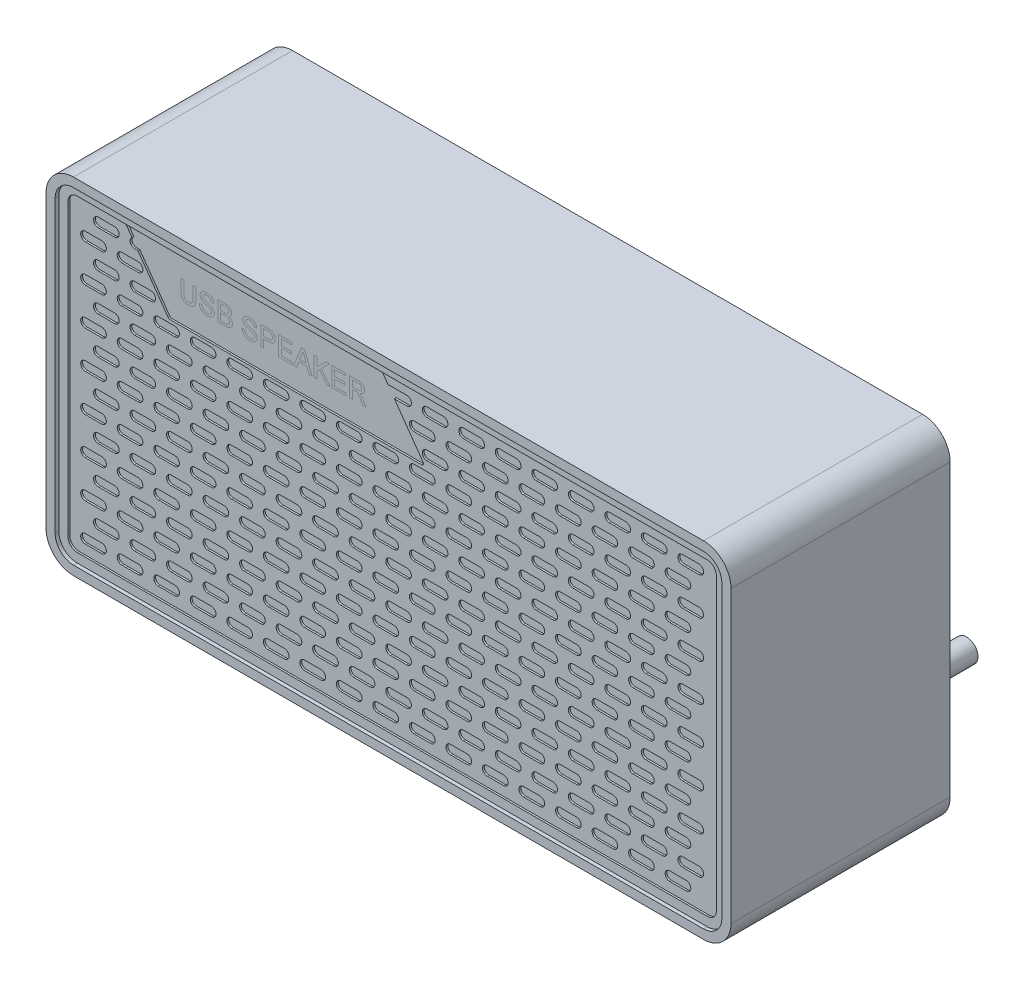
SolidWorks part; units mm, degrees
ref_plane "Front Plane" through (0, 0, 0) normal (0, 0, 1) x (1, 0, 0)
ref_plane "Top Plane" through (0, 0, 0) normal (0, 1, 0) x (1, 0, 0)
ref_plane "Right Plane" through (0, 0, 0) normal (1, 0, 0) x (0, 0, -1)
sketch "Sketch1" plane through (0, 0, 0) normal (0, 1, 0) x (1, 0, 0)
  line L1 (-47.498, 15.1892) -> (47.498, 15.1892)
  line L2 (-47.498, 15.1892) -> (-47.498, -15.1892)
  line L3 (-47.498, -15.1892) -> (47.498, -15.1892)
  line L4 (47.498, 15.1892) -> (47.498, -15.1892)
  line L5 (-47.498, 15.1892) -> (47.498, -15.1892) construction
  line L6 (-47.498, -15.1892) -> (47.498, 15.1892) construction
  point P0 (0, 0)
  dimension "D1" = 94.996
  dimension "D2" = 30.3784
extrude "Boss-Extrude1" add sketch "Sketch1" along normal blind 47.879
fillet "Fillet1" radius 3.81 4 edges at (-47.498, 0, 0) (-47.498, 47.879, 0) (47.498, 0, 0) (47.498, 47.879, 0)
sketch "Sketch2" plane through (0, 0, 15.1892) normal (0, 0, 1) x (1, 0, 0)
  line L0 (-43.688, 47.879) -> (43.688, 47.879) construction
  line L1 (-46.228, 46.609) -> (46.228, 46.609)
  line L2 (-46.228, 46.609) -> (-46.228, 1.27)
  line L3 (-46.228, 1.27) -> (46.228, 1.27)
  line L4 (46.228, 46.609) -> (46.228, 1.27)
  line L5 (-43.688, 0) -> (43.688, 0) construction
  line L6 (-47.498, 44.069) -> (-47.498, 3.81) construction
  line L7 (47.498, 44.069) -> (47.498, 3.81) construction
  dimension "D1" = 1.27
  dimension "D2" = 1.27
  dimension "D3" = 1.27
  dimension "D4" = 1.27
extrude "Cut-Extrude1" cut sketch "Sketch2" against normal blind 0.508
fillet "Fillet2" radius 2.54 4 edges at (46.228, 1.27, 14.9352) (46.228, 46.609, 14.9352) (-46.228, 1.27, 14.9352) (-46.228, 46.609, 14.9352)
sketch "Sketch3" plane through (0, 0, 14.6812) normal (0, 0, 1) x (1, 0, 0)
  line L0 (43.688, 46.609) -> (-43.688, 46.609) construction
  line L1 (-44.958, 45.339) -> (44.958, 45.339)
  line L2 (-44.958, 45.339) -> (-44.958, 2.54)
  line L3 (-44.958, 2.54) -> (44.958, 2.54)
  line L4 (44.958, 45.339) -> (44.958, 2.54)
  line L5 (-43.688, 1.27) -> (43.688, 1.27) construction
  line L6 (-46.228, 44.069) -> (-46.228, 3.81) construction
  line L7 (46.228, 3.81) -> (46.228, 44.069) construction
  dimension "D1" = 1.27
  dimension "D2" = 1.27
  dimension "D3" = 1.27
  dimension "D4" = 1.27
extrude "Cut-Extrude2" cut sketch "Sketch3" against normal blind 0.254
fillet "Fillet3" radius 1.27 4 edges at (44.958, 2.54, 14.5542) (44.958, 45.339, 14.5542) (-44.958, 2.54, 14.5542) (-44.958, 45.339, 14.5542)
sketch "Sketch6" plane through (0, 0, 14.4272) normal (0, 0, 1) x (1, 0, 0)
  line L0 (-37.338, 45.339) -> (-1.778, 45.339)
  line L1 (-1.778, 45.339) -> (4.318, 36.703)
  line L2 (4.318, 36.703) -> (-31.242, 36.703)
  line L3 (-31.242, 36.703) -> (-37.338, 45.339)
  line L4 (-44.958, 44.069) -> (-44.958, 3.81) construction
  line L5 (43.688, 45.339) -> (-43.688, 45.339) construction
  dimension "D1" = 35.56
  dimension "D2" = 8.636
  dimension "D3" = 6.096
  dimension "D4" = 7.62
extrude "Cut-Extrude5" cut sketch "Sketch6" against normal blind 0.254
fillet "Fillet4" radius 0.254 4 edges at (-1.778, 45.339, 14.3002) (4.318, 36.703, 14.3002) (-37.338, 45.339, 14.3002) (-31.242, 36.703, 14.3002)
sketch "Sketch5" plane through (0, 0, 14.4272) normal (0, 0, 1) x (1, 0, 0)
  line L0 (-42.8133, 4.4973) -> (-40.5273, 4.4973) construction
  line L1 (-42.8133, 5.1323) -> (-40.5273, 5.1323)
  line L2 (-42.8133, 3.8623) -> (-40.5273, 3.8623)
  line L4 (-43.688, 2.54) -> (43.688, 2.54) construction
  line L5 (-44.958, 44.069) -> (-44.958, 3.81) construction
  line L6 (-41.0353, 7.0896) -> (-38.7493, 7.0896) construction
  line L7 (-41.0353, 7.7246) -> (-38.7493, 7.7246)
  line L8 (-41.0353, 6.4546) -> (-38.7493, 6.4546)
  arc A0 (-42.8133, 5.1323) -> (-42.8133, 3.8623) centre (-42.8133, 4.4973) ccw
  arc A1 (-40.5273, 3.8623) -> (-40.5273, 5.1323) centre (-40.5273, 4.4973) ccw
  arc A2 (-41.0353, 7.7246) -> (-41.0353, 6.4546) centre (-41.0353, 7.0896) ccw
  arc A3 (-38.7493, 6.4546) -> (-38.7493, 7.7246) centre (-38.7493, 7.0896) ccw
  point P2 (-41.6703, 4.4973)
  point P7 (-39.8923, 4.4973)
  point P8 (-43.4483, 4.4973)
  point P15 (-39.8923, 7.0896)
  point P20 (-41.6703, 7.0896)
  dimension "D1" = 3.556
  dimension "D2" = 5.0657
  dimension "D3" = 1.27
  dimension "D4" = 1.3223
  dimension "D5" = 1.3223
extrude "Cut-Extrude4" cut sketch "Sketch5" against normal blind 0.254
pattern_linear "LPattern1" count 17 spacing 5.0657 along (1, 0, 0) count 8 spacing 5.1846 along (0, 1, 0) of "Cut-Extrude4"
sketch "Sketch8" plane through (0, 0, -15.1892) normal (0, 0, -1) x (-1, 0, 0)
  line L0 (-43.688, 47.879) -> (43.688, 47.879) construction
  line L1 (-46.228, 46.609) -> (46.228, 46.609)
  line L2 (-46.228, 46.609) -> (-46.228, 1.27)
  line L3 (-46.228, 1.27) -> (46.228, 1.27)
  line L4 (46.228, 46.609) -> (46.228, 1.27)
  line L5 (-43.688, 0) -> (43.688, 0) construction
  line L6 (-47.498, 44.069) -> (-47.498, 3.81) construction
  line L7 (47.498, 44.069) -> (47.498, 3.81) construction
  dimension "D1" = 1.27
  dimension "D2" = 1.27
  dimension "D3" = 1.27
  dimension "D4" = 1.27
extrude "Cut-Extrude7" cut sketch "Sketch8" against normal blind 0.254
fillet "Fillet5" radius 2.54 4 edges at (-46.228, 1.27, -15.0622) (-46.228, 46.609, -15.0622) (46.228, 1.27, -15.0622) (46.228, 46.609, -15.0622)
sketch "Sketch9" plane through (0, 0, -14.9352) normal (0, 0, -1) x (-1, 0, 0)
  line L0 (-41.6703, 4.4973) -> (-39.3843, 4.4973) construction
  line L1 (-41.6703, 5.1323) -> (-39.3843, 5.1323)
  line L2 (-41.6703, 3.8623) -> (-39.3843, 3.8623)
  line L3 (-43.4483, 7.0896) -> (-41.1623, 7.0896) construction
  line L4 (-43.4483, 7.7246) -> (-41.1623, 7.7246)
  line L5 (-43.4483, 6.4546) -> (-41.1623, 6.4546)
  line L6 (-43.688, 1.27) -> (43.688, 1.27) construction
  line L9 (-46.228, 44.069) -> (-46.228, 3.81) construction
  arc A0 (-41.6703, 5.1323) -> (-41.6703, 3.8623) centre (-41.6703, 4.4973) ccw
  arc A1 (-39.3843, 3.8623) -> (-39.3843, 5.1323) centre (-39.3843, 4.4973) ccw
  arc A2 (-43.4483, 7.7246) -> (-43.4483, 6.4546) centre (-43.4483, 7.0896) ccw
  arc A3 (-41.1623, 6.4546) -> (-41.1623, 7.7246) centre (-41.1623, 7.0896) ccw
  point P2 (-40.5273, 4.4973)
  point P9 (-42.3053, 7.0896)
  point P14 (-42.3053, 4.4973)
  point P15 (-38.7493, 4.4973)
  point P18 (-40.5273, 7.0896)
  dimension "D1" = 3.556
  dimension "D2" = 1.27
  dimension "D3" = 2.5923
  dimension "D4" = 1.3223
  dimension "D5" = 5.7007
extrude "Cut-Extrude8" cut sketch "Sketch9" against normal blind 0.254
pattern_linear "LPattern3" count 17 spacing 5.207 along (-1, 0, 0) count 8 spacing 5.1846 along (0, 1, 0) of "Cut-Extrude8"
sketch "Sketch10" plane through (0, 0, -14.9352) normal (0, 0, -1) x (-1, 0, 0)
  line L0 (-43.688, 1.27) -> (43.688, 1.27) construction
  line L1 (-46.228, 44.069) -> (-46.228, 3.81) construction
  circle A0 centre (-37.338, 10.16) radius 1.5875
  dimension "D1" = 3.175
  dimension "D2" = 8.89
  dimension "D3" = 8.89
extrude "Boss-Extrude2" add sketch "Sketch10" along normal blind 12.7
sketch "Sketch11" plane through (0, 0, 0) normal (0, -1, 0) x (1, 0, 0)
  line L0 (-37.973, 10.795) -> (-37.973, -10.795) construction
  line L1 (-34.798, 10.795) -> (-34.798, -10.795)
  line L2 (-41.148, 10.795) -> (-41.148, -10.795)
  line L3 (37.973, 10.795) -> (37.973, -10.795) construction
  line L4 (41.148, 10.795) -> (41.148, -10.795)
  line L5 (34.798, 10.795) -> (34.798, -10.795)
  line L6 (-43.688, 15.1892) -> (-43.688, -15.1892) construction
  line L7 (-43.688, 15.1892) -> (43.688, 15.1892) construction
  line L8 (43.688, -15.1892) -> (43.688, 15.1892) construction
  arc A0 (-34.798, 10.795) -> (-41.148, 10.795) centre (-37.973, 10.795) ccw
  arc A1 (-41.148, -10.795) -> (-34.798, -10.795) centre (-37.973, -10.795) ccw
  arc A2 (41.148, 10.795) -> (34.798, 10.795) centre (37.973, 10.795) ccw
  arc A3 (34.798, -10.795) -> (41.148, -10.795) centre (37.973, -10.795) ccw
  point P2 (-37.973, 0)
  point P9 (37.973, 0)
  dimension "D1" = 2.54
  dimension "D2" = 6.35
  dimension "D3" = 15.1892
  dimension "D4" = 21.59
  dimension "D5" = 2.54
extrude "Boss-Extrude3" add sketch "Sketch11" along normal blind 0.635
sketch "Sketch17" plane through (0, 0, 14.1732) normal (0, 0, 1) x (1, 0, 0)
  line L0 (-31.1104, 36.703) -> (3.8278, 36.703) construction
  text T0 "USB SPEAKER" font "Arial" height 2.667
  dimension "D1" = 2.794
  dimension "D2" = 1.016
wrap "Wrap1" sketch "Sketch17" wrap type scribe source sketch "Sketch17"
